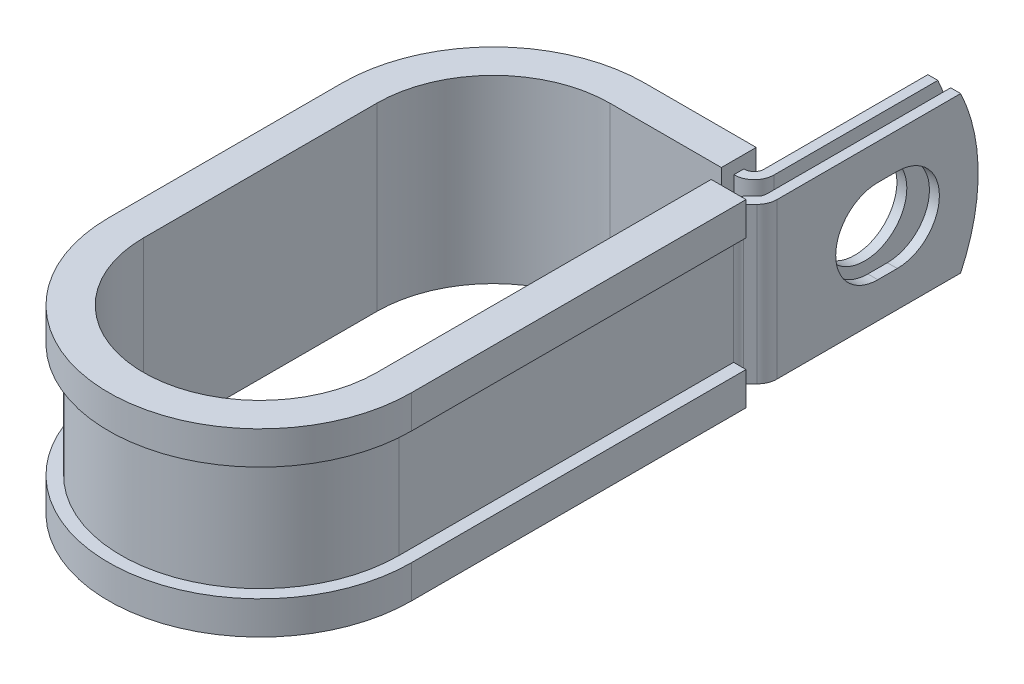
SolidWorks part; units mm, degrees
ref_plane "Front Plane" through (0, 0, 0) normal (0, 0, 1) x (1, 0, 0)
ref_plane "Top Plane" through (0, 0, 0) normal (0, 1, 0) x (1, 0, 0)
ref_plane "Right Plane" through (0, 0, 0) normal (1, 0, 0) x (0, 0, -1)
sketch "Sketch1" plane through (0, 0, 0) normal (0, 1, 0) x (1, 0, 0)
  line L0 (0, 15.8115) -> (13.6958, 15.8115)
  line L1 (15.8115, 0) -> (15.8115, 12.399)
  line L2 (16.1342, 40.4622) -> (16.1342, 18.2499)
  line L3 (16.5257, 14.1232) -> (17.3519, 14.9494)
  line L4 (-15.8115, 0) -> (-15.8115, -28.575)
  line L5 (17.709, 15.8115) -> (17.709, 40.4622)
  line L6 (15.8115, 0) -> (15.8115, -28.575)
  arc A0 (0, 15.8115) -> (-15.8115, 0) centre (0, 0) ccw
  arc A1 (16.5257, 14.1232) -> (15.8115, 12.399) centre (18.2499, 12.399) ccw
  arc A2 (17.3519, 14.9494) -> (17.709, 15.8115) centre (16.4898, 15.8115) ccw
  arc A3 (13.6958, 15.8115) -> (16.1342, 18.2499) centre (13.6958, 18.2499) ccw
  arc A4 (-15.8115, -28.575) -> (15.8115, -28.575) centre (0, -28.575) ccw
extrude "Extrude-Thin1" add sketch "Sketch1" along normal mid plane 19.05 thin
sketch "Sketch2" plane through (14.915, 0, 0) normal (-1, 0, 0) x (0, 0, 1)
  line L0 (-40.4622, 9.525) -> (-40.4622, -9.525) construction
  line L1 (0, 9.525) -> (0, -9.525) construction
  circle A0 centre (-29.3624, 0) radius 5.1562
  point P2 (-40.4622, 0)
extrude "Cut-Extrude1" cut sketch "Sketch2" against normal up to surface (1.2192 mm away)
sketch "Sketch3" plane through (18.9282, 0, 0) normal (1, 0, 0) x (0, 0, -1)
  line L0 (28.1686, 0) -> (30.5562, 0) construction
  line L1 (28.1686, 5.1562) -> (30.5562, 5.1562)
  line L2 (28.1686, -5.1562) -> (30.5562, -5.1562)
  line L3 (40.4622, 9.525) -> (40.4622, -9.525) construction
  arc A0 (28.1686, 5.1562) -> (28.1686, -5.1562) centre (28.1686, 0) ccw
  arc A1 (30.5562, -5.1562) -> (30.5562, 5.1562) centre (30.5562, 0) ccw
  point P3 (29.3624, 0)
  point P8 (40.4622, 0)
  point P11 (23.0124, 0)
  point P12 (35.7124, 0)
extrude "Cut-Extrude2" cut sketch "Sketch3" against normal up to surface (1.2192 mm away)
sketch "Sketch4" plane through (14.915, 0, 0) normal (-1, 0, 0) x (0, 0, 1)
  line L0 (-40.4622, 9.525) -> (-40.4622, -9.525)
  line L1 (-40.4622, 9.525) -> (-38.3177, 9.525)
  line L2 (-40.4622, 9.525) -> (-18.2499, 9.525) construction
  line L3 (-40.4622, -9.525) -> (-38.3177, -9.525)
  line L4 (-40.4622, -9.525) -> (-18.2499, -9.525) construction
  arc A0 (-38.3177, 9.525) -> (-38.3177, -9.525) centre (-18.2372, 0) ccw
extrude "Cut-Extrude3" cut sketch "Sketch4" against normal through all contours A0 M4 M5 | A0 L0 M2
ref_plane "Plane1" through (0, 0, -12.399) normal (0, 0, -1) x (-1, 0, 0)
ref_plane "Plane2" through (13.645, 0, 0) normal (-1, 0, 0) x (0, 0, 1)
sketch "Sketch5" plane through (0, 0, -12.399) normal (0, 0, -1) x (-1, 0, 0)
  line L0 (-17.0307, 9.525) -> (-15.8115, 9.525)
  line L1 (-17.0307, 9.525) -> (-17.0307, -9.525) construction
  line L3 (-15.8115, 9.525) -> (-15.8115, -9.525)
  line L4 (-15.8115, -9.525) -> (-17.0307, -9.525)
  line L5 (-17.0307, -9.525) -> (-17.0307, -6.985)
  line L6 (-17.0307, 9.525) -> (-17.0307, 6.985)
  line L7 (-18.5547, 11.049) -> (-18.5547, 6.985)
  line L8 (-18.5547, 11.049) -> (-14.2875, 11.049)
  line L9 (-14.2875, 11.049) -> (-14.2875, -11.049)
  line L10 (-14.2875, -11.049) -> (-18.5547, -11.049)
  line L11 (-18.5547, -11.049) -> (-18.5547, -6.985)
  line L12 (-18.5547, 6.985) -> (-17.0307, 6.985)
  line L13 (-17.0307, -6.985) -> (-18.5547, -6.985)
sketch "Sketch6" plane through (0, 9.525, 0) normal (0, 1, 0) x (1, 0, 0)
  line L0 (14.2875, 0) -> (14.2875, 12.399)
  line L1 (14.2875, 12.399) -> (18.5547, 12.399) construction
  line L2 (13.645, 6.9878) -> (13.645, -6.9878) construction
  line L3 (14.2875, -28.575) -> (14.2875, 0)
  line L4 (-14.2875, -28.575) -> (-14.2875, 0)
  line L5 (0, 14.2875) -> (13.645, 14.2875)
  arc A0 (0, 14.2875) -> (-14.2875, 0) centre (0, 0) ccw
  arc A1 (-14.2875, -28.575) -> (14.2875, -28.575) centre (0, -28.575) ccw
sweep "Sweep1" add profiles "Sketch5" path "Sketch6"
equation "\"D4@Sketch5\" = \"D1@Extrude-Thin1\""
equation "\"D5@Sketch5\" = \"D5@Extrude-Thin1\""
equation "\"D1@Sketch3\" = \"D2@Sketch2\""
equation "\"D7@Sketch1\" = \"D3@Sketch2\" + \"D1@Sketch3\""
equation "\"D1@Sketch1\" = \"D1@Sketch6\" + 2 * \"D3@Sketch5\""
equation "\"D1@Sketch4\" = ( \"D1@Extrude-Thin1\" + .125 ) * 2"
equation "\"D9@Sketch1\"= \"D5@Extrude-Thin1\""
equation "\"D8@Sketch1\"= 2 * \"D5@Extrude-Thin1\""
equation "\"D2@Sketch1\" = 2 * \"D5@Extrude-Thin1\""
equation "\"D2@Sketch3\" = \"D1@Sketch2\""
equation "\"D6@Sketch1\" = \"D1@Sketch1\""
equation "\"D3@Sketch1\" = \"D1@Sketch6\""
